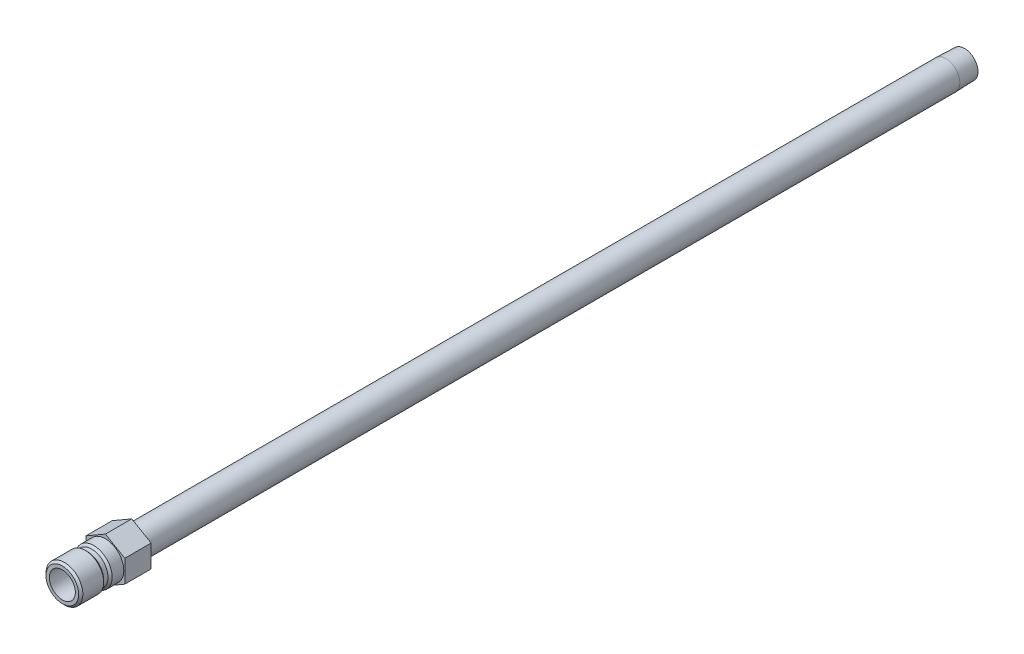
SolidWorks part; units mm, degrees
ref_plane "Front Plane" through (0, 0, 0) normal (0, 0, 1) x (1, 0, 0)
ref_plane "Top Plane" through (0, 0, 0) normal (0, 1, 0) x (1, 0, 0)
ref_plane "Right Plane" through (0, 0, 0) normal (1, 0, 0) x (0, 0, -1)
sketch "Sketch1" plane through (0, 0, 0) normal (1, 0, 0) x (0, 0, -1)
  line L0 (9.652, 0) -> (-18.923, 0) construction
  line L1 (-15.748, 4.7625) -> (-15.748, 5.9817)
  line L2 (-6.604, 5.9817) -> (-6.604, 0) construction
  line L3 (-14.986, 6.7437) -> (-7.366, 6.7437)
  line L4 (9.652, 5.1435) -> (9.652, 0) construction
  line L5 (-6.604, 5.9817) -> (-5.0165, 5.9817)
  line L6 (-4.2545, 6.7437) -> (9.652, 6.7437)
  line L7 (9.652, 6.7437) -> (9.652, 5.1435)
  line L8 (-6.604, 5.9817) -> (-7.366, 6.7437)
  line L9 (-5.0165, 5.9817) -> (-4.2545, 6.7437)
  line L10 (-15.748, 5.9817) -> (-14.986, 6.7437)
  line L11 (-15.748, 4.7625) -> (-3.556, 4.7625)
  line L12 (9.652, 5.1435) -> (307.594, 5.1435)
  line L13 (307.594, 5.1435) -> (314.452, 4.9292)
  line L14 (314.452, 4.9292) -> (314.452, 3.4163)
  line L15 (0, 0) -> (0, 6.7437) construction
  line L16 (9.652, 6.731) -> (9.652, 0) construction
  line L17 (-3.556, 4.7625) -> (-2.8402, 3.4163)
  line L19 (-2.8402, 3.4163) -> (314.452, 3.4163)
  dimension "D2" = 1.5875
  dimension "D3" = 0.762
  dimension "D4" = 45
  dimension "D5" = 9.144
  dimension "D6" = 45
  dimension "D7" = 1.79
  dimension "D8" = 6.858
  dimension "D9" = 330.2
  dimension "D10" = 3.175
  dimension "D11" = 9.525
  dimension "D12" = 10.287
  dimension "D13" = 25.4
  dimension "D14" = 13.4874
  dimension "D15" = 6.8326
  dimension "D16" = 12.192
  dimension "D17" = 9.652
  dimension "D18" = 118
revolve "Revolve1" add sketch "Sketch1" angle 360 about L0
sketch "Sketch2" plane through (0, 0, 0) normal (0, 0, 1) x (1, 0, 0)
  line L1 (-7.112, 4.1061) -> (-7.112, -4.1061)
  line L2 (-7.112, -4.1061) -> (0, -8.2122)
  line L3 (0, -8.2122) -> (7.112, -4.1061)
  line L4 (7.112, -4.1061) -> (7.112, 4.1061)
  line L5 (7.112, 4.1061) -> (0, 8.2122)
  line L6 (0, 8.2122) -> (-7.112, 4.1061)
  circle A0 centre (0, 0) radius 7.112 construction
  circle A1 centre (0, 0) radius 4.7625 construction
  circle A2 centre (0, 0) radius 4.7625
  dimension "D1" = 14.224
extrude "Boss-Extrude1" add sketch "Sketch2" against normal up to vertex (9.652 mm away)
